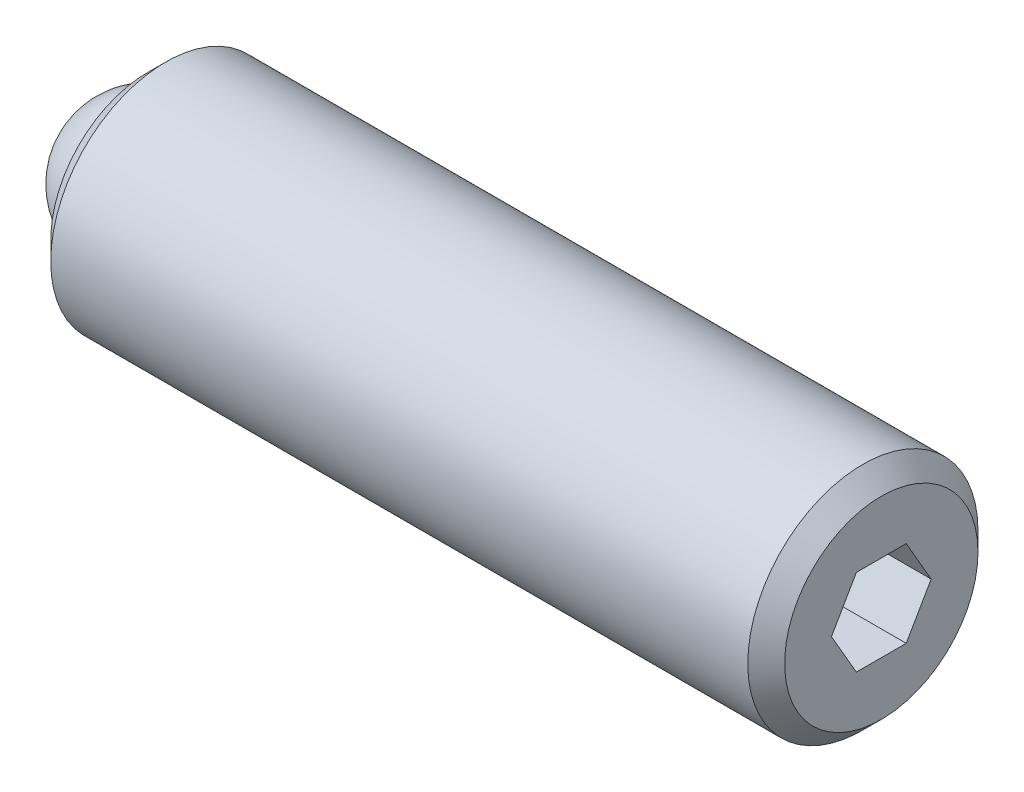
SolidWorks part; units mm, degrees
ref_plane "Front Plane" through (0, 0, 0) normal (0, 0, 1) x (1, 0, 0)
ref_plane "Top Plane" through (0, 0, 0) normal (0, 1, 0) x (1, 0, 0)
ref_plane "Right Plane" through (0, 0, 0) normal (1, 0, 0) x (0, 0, -1)
sketch "Sketch2" plane through (0, 0, 0) normal (1, 0, 0) x (0, 0, -1)
  circle A0 centre (0, 0) radius 3.175
  dimension "D1" = 6.35
extrude "Boss-Extrude1" add sketch "Sketch2" along normal blind 20.2406
sketch "Sketch3" plane through (0, 0, 0) normal (-1, 0, 0) x (0, 0, 1)
  circle A0 centre (0, 0) radius 1.9812
  dimension "D1" = 3.9624
chamfer "Chamfer1" distance 0.508 angle 45 1 edges at (0, 0, -3.175)
chamfer "Chamfer2" distance 0.508 angle 45 1 edges at (20.2406, 0, -3.175)
sketch "Sketch4" plane through (20.2406, 0, 0) normal (1, 0, 0) x (0, 0, -1)
  line L1 (1.3748, 0) -> (0.6874, 1.1906)
  line L2 (0.6874, 1.1906) -> (-0.6874, 1.1906)
  line L3 (-0.6874, 1.1906) -> (-1.3748, 0)
  line L4 (-1.3748, 0) -> (-0.6874, -1.1906)
  line L5 (-0.6874, -1.1906) -> (0.6874, -1.1906)
  line L6 (0.6874, -1.1906) -> (1.3748, 0)
  circle A0 centre (0, 0) radius 1.1906 construction
  dimension "D1" = 2.3813
extrude "Cut-Extrude2" cut sketch "Sketch4" against normal blind 2.286
extrude "Cut-Extrude3" cut sketch "Sketch3" against normal blind 1.9844
sketch "Sketch5" plane through (0, 0, 0) normal (-1, 0, 0) x (0, 0, 1)
  line L0 (0, 0) -> (0, -1.9844)
  line L1 (0, 0) -> (0, 1.9844)
  arc A0 (0, 1.9844) -> (0, -1.9844) centre (0, 0) ccw
  dimension "D1" = 1.9844
revolve "Revolve1" add sketch "Sketch5" angle 360 about L1
